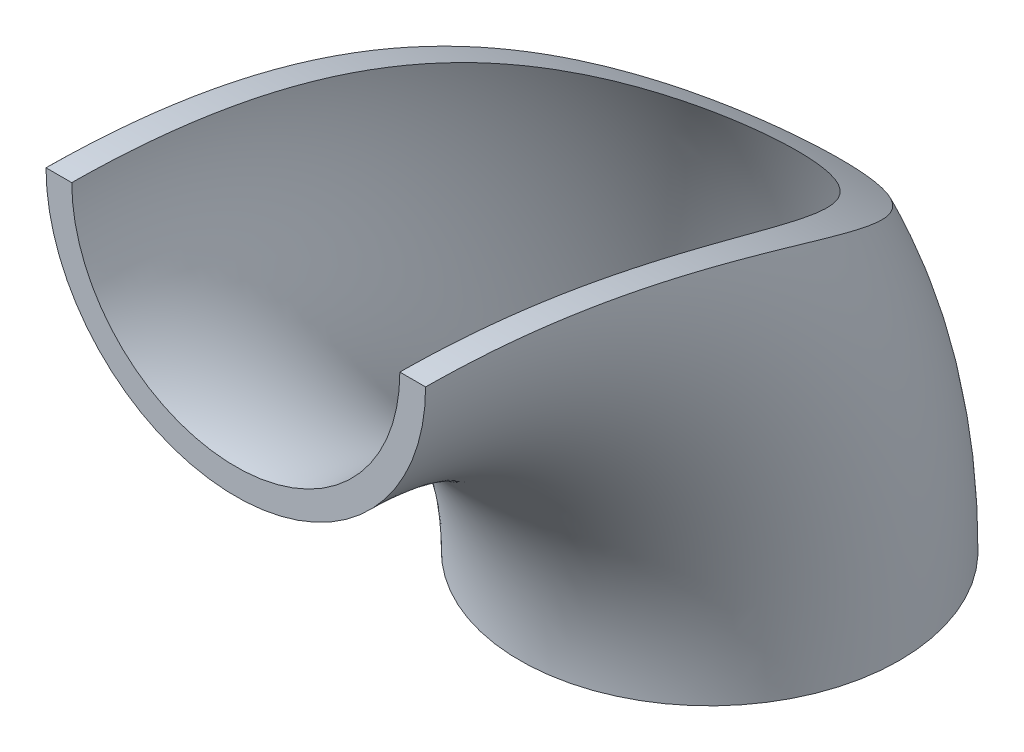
SolidWorks part; units mm, degrees
ref_plane "Plan de face" through (0, 0, 0) normal (0, 0, 1) x (1, 0, 0)
ref_plane "Plan de dessus" through (0, 0, 0) normal (0, 1, 0) x (1, 0, 0)
ref_plane "Plan de droite" through (0, 0, 0) normal (1, 0, 0) x (0, 0, -1)
sketch "Esquisse1" plane through (0, 0, 0) normal (0, 0, 1) x (1, 0, 0)
  circle A0 centre (0, 0) radius 32.89
  circle A1 centre (0, 0) radius 38.05
  dimension "D1" = 65.78
  dimension "D2" = 76.1
sketch "Esquisse2" plane through (0, 0, 0) normal (1, 0, 0) x (0, 0, -1)
  line L1 (77.4807, -95) -> (-85.8033, -95) construction
  arc A0 (95, -95) -> (0, 0) centre (0, -95) ccw
  dimension "D1" = 95
sweep "Balayage2" add profiles "Esquisse1" path "Esquisse2"
sketch "Esquisse4" plane through (0, 0, 0) normal (-1, 0, 0) x (0, 0, 1)
  line L1 (2.9537, 0) -> (33.4139, 56.7556)
  line L3 (33.4139, 56.7556) -> (-140.8618, 61.9374)
  line L4 (-140.8618, 61.9374) -> (-126.5145, -43.8176)
  spline S0 degree 2 poles (-126.5145, -43.8176) (-65.5483, 0.4833) (2.9537, 0) knots 0 0 0 1 1 1
extrude "Enlèv. mat.-Extru.1" cut sketch "Esquisse4" against normal mid plane 130
